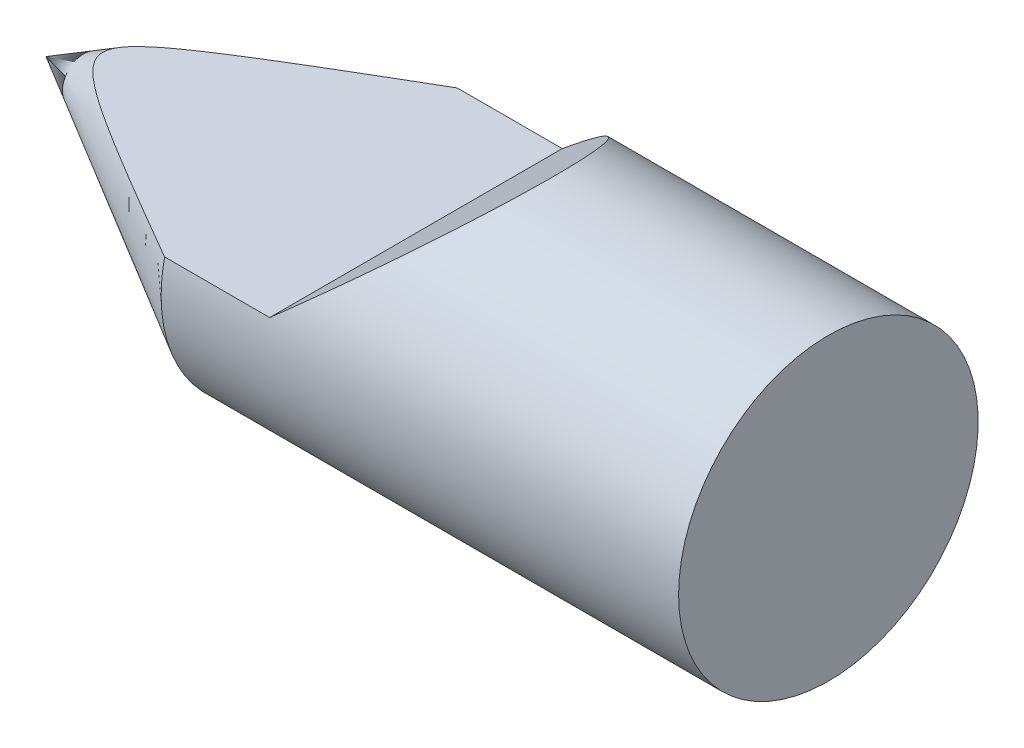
SolidWorks part; units mm, degrees
ref_plane "前视基准面" through (0, 0, 0) normal (0, 0, 1) x (1, 0, 0)
ref_plane "上视基准面" through (0, 0, 0) normal (0, 1, 0) x (1, 0, 0)
ref_plane "右视基准面" through (0, 0, 0) normal (1, 0, 0) x (0, 0, -1)
sketch "草图1" plane through (0, 0, 0) normal (0, 0, 1) x (1, 0, 0)
  line L0 (-78.0644, 0) -> (67.4528, 0) construction
  line L1 (-64.7006, 0) -> (-32.9244, 17.9669)
  line L2 (-32.9244, 17.9669) -> (29.1432, 17.9669)
  line L3 (29.1432, 17.9669) -> (29.1432, 0)
  line L4 (29.1432, 0) -> (-64.7006, 0)
revolve "旋转1" add sketch "草图1" angle 360 about L0
sketch "草图2" plane through (0, 0, 0) normal (0, 0, 1) x (1, 0, 0)
  line L0 (2.7788, 23.6381) -> (-20.3262, 3.8508)
  line L1 (-20.3262, 3.8508) -> (-66.0621, 3.8508)
  line L2 (-66.0621, 3.8508) -> (-42.0093, 23.6381)
  line L3 (-42.0093, 23.6381) -> (2.7788, 23.6381)
extrude "切除-拉伸1" cut sketch "草图2" against normal through all and the other way through all
